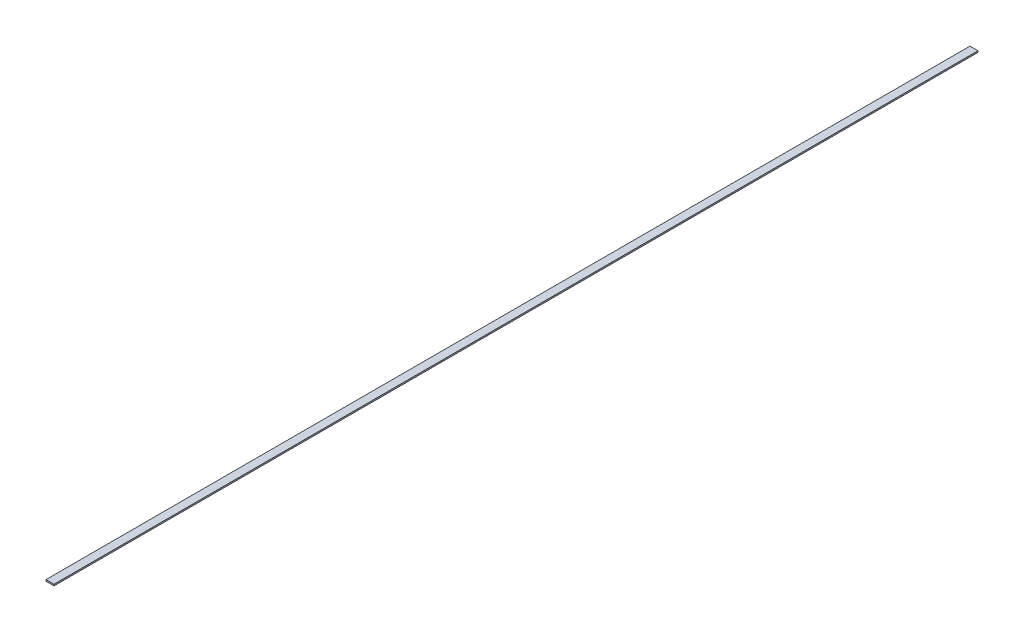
SolidWorks part; units mm, degrees
ref_plane "Front" through (0, 0, 0) normal (0, 0, 1) x (1, 0, 0)
ref_plane "Top" through (0, 0, 0) normal (0, 1, 0) x (1, 0, 0)
ref_plane "Right" through (0, 0, 0) normal (1, 0, 0) x (0, 0, -1)
sketch "Sketch1" plane through (0, 0, 0) normal (0, 0, 1) x (1, 0, 0)
  line L1 (-3.9688, 0.7239) -> (3.9688, 0.7239)
  line L2 (-3.9688, 0.7239) -> (-3.9688, -0.7239)
  line L3 (-3.9688, -0.7239) -> (3.9688, -0.7239)
  line L4 (3.9688, 0.7239) -> (3.9688, -0.7239)
  point P4 (0, 0.7239)
  point P6 (-3.9688, 0)
  dimension "BladeWidth" = 7.9375
  dimension "BladeThick" = 1.4478
extrude "Extrude1" add sketch "Sketch1" along normal mid plane 914.4
